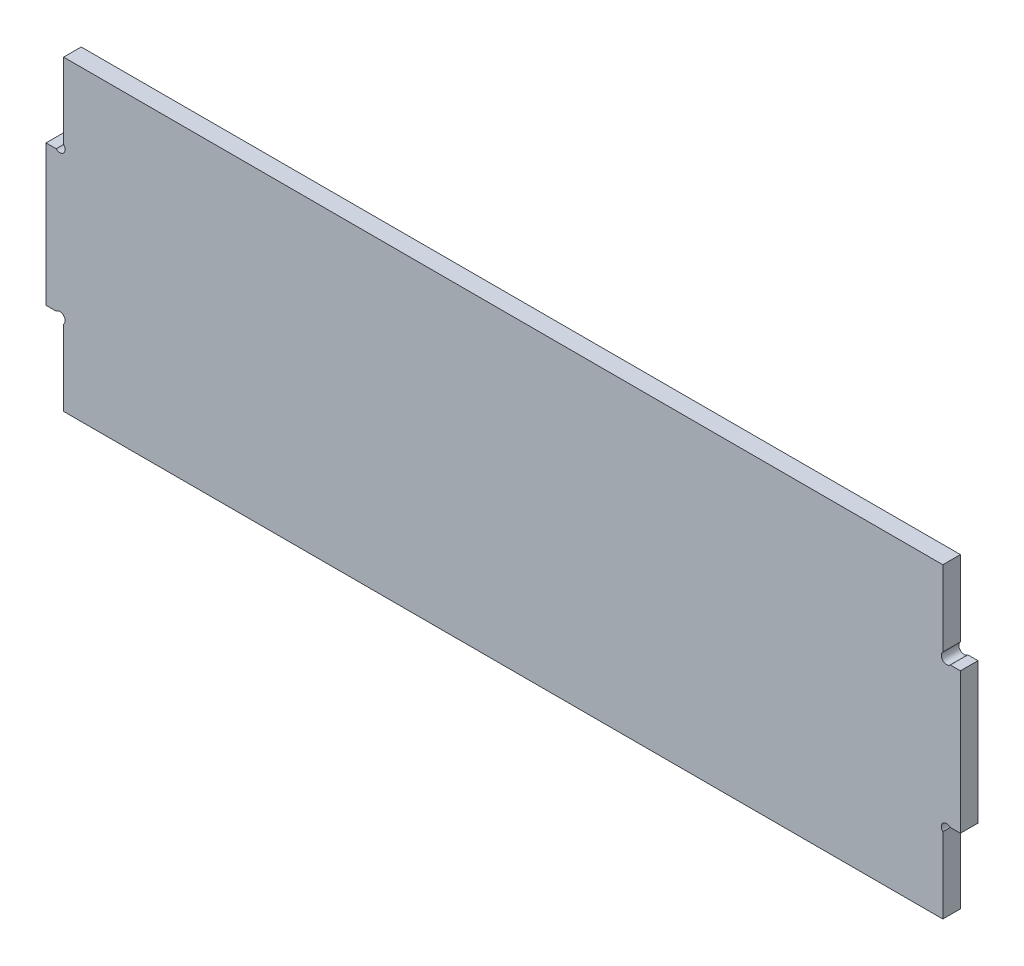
SolidWorks part; units mm, degrees
ref_plane "Alzado" through (0, 0, 0) normal (0, 0, 1) x (1, 0, 0)
ref_plane "Planta" through (0, 0, 0) normal (0, 1, 0) x (1, 0, 0)
ref_plane "Vista lateral" through (0, 0, 0) normal (1, 0, 0) x (0, 0, -1)
ref_plane "Plano1" through (0, 0, 10) normal (0, 0, 1) x (1, 0, 0)
sketch "Croquis3" plane through (0, 0, 10) normal (0, 0, 1) x (1, 0, 0)
  line L0 (-500, 173.6398) -> (0, 173.6398)
  line L1 (-500, 173.6398) -> (-500, -0.8556)
  line L2 (0, 173.6398) -> (0, -0.8556)
  line L3 (-500, -0.8556) -> (0, -0.8556)
  line L9 (-500, -0.8556) -> (0, -0.8556) construction
extrude "Saliente-Extruir3" add sketch "Croquis3" against normal blind 10
sketch "Croquis4" plane through (-500, 0, 0) normal (-1, 0, 0) x (0, 0, 1)
  line L0 (0, 86.3921) -> (10, 86.3921) construction
  line L1 (0, 173.6398) -> (0, -0.8556) construction
  line L2 (10, 173.6398) -> (10, -0.8556) construction
  line L3 (0, 46.3921) -> (10, 46.3921)
  line L4 (0, 46.3921) -> (0, 126.3921)
  line L5 (10, 46.3921) -> (10, 126.3921)
  line L6 (0, 126.3921) -> (10, 126.3921)
  point P6 (0, 86.3921)
  dimension "D1" = 80
extrude "Saliente-Extruir4" add sketch "Croquis4" along normal blind 10
sketch "Croquis5" plane through (0, 0, 10) normal (0, 0, 1) x (1, 0, 0)
  line L0 (-502.1213, 128.5134) -> (-502.1213, 126.3921) construction
  line L1 (-510, 126.3921) -> (-500, 126.3921) construction
  line L2 (-502.1213, 128.5134) -> (-500, 128.5134) construction
  line L3 (-500, 173.6398) -> (-500, 126.3921) construction
  line L4 (-510, 86.3921) -> (-479.9084, 86.3921) construction
  line L5 (-510, 46.3921) -> (-510, 126.3921) construction
  line L6 (-502.1213, 44.2708) -> (-500, 44.2708) construction
  line L7 (-502.1213, 44.2708) -> (-502.1213, 46.3921) construction
  circle A0 centre (-502.1213, 128.5134) radius 3
  circle A1 centre (-502.1213, 44.2708) radius 3
  dimension "D1" = 6
extrude "Cortar-Extruir1" cut sketch "Croquis5" against normal through all both and the other way through all
ref_plane "Plano2" through (-250, 0, 0) normal (-1, 0, 0) x (0, 0, 1)
mirror "Simetría1" about plane through (-250, 0, 0) normal (-1, 0, 0) of "Saliente-Extruir4", "Cortar-Extruir1"
